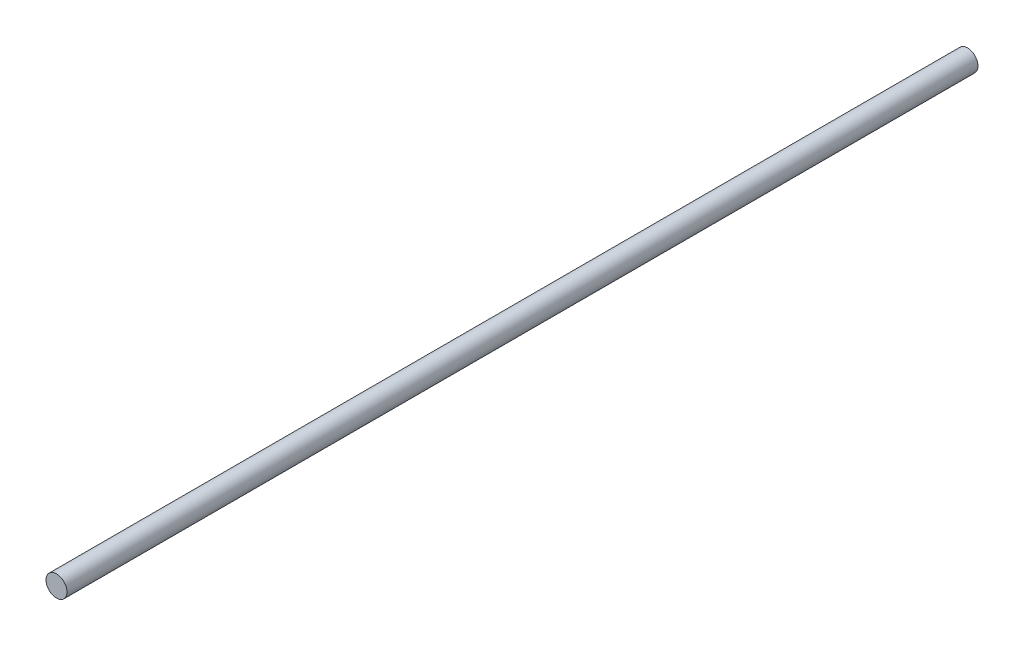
SolidWorks part; units mm, degrees
ref_plane "Front Plane" through (0, 0, 0) normal (0, 0, 1) x (1, 0, 0)
ref_plane "Top Plane" through (0, 0, 0) normal (0, 1, 0) x (1, 0, 0)
ref_plane "Right Plane" through (0, 0, 0) normal (1, 0, 0) x (0, 0, -1)
sketch "Sketch1" plane through (0, 0, 0) normal (0, 0, 1) x (1, 0, 0)
  circle A0 centre (0, 0) radius 1.5
  dimension "D1" = 3
extrude "Boss-Extrude1" add sketch "Sketch1" along normal mid plane 130
